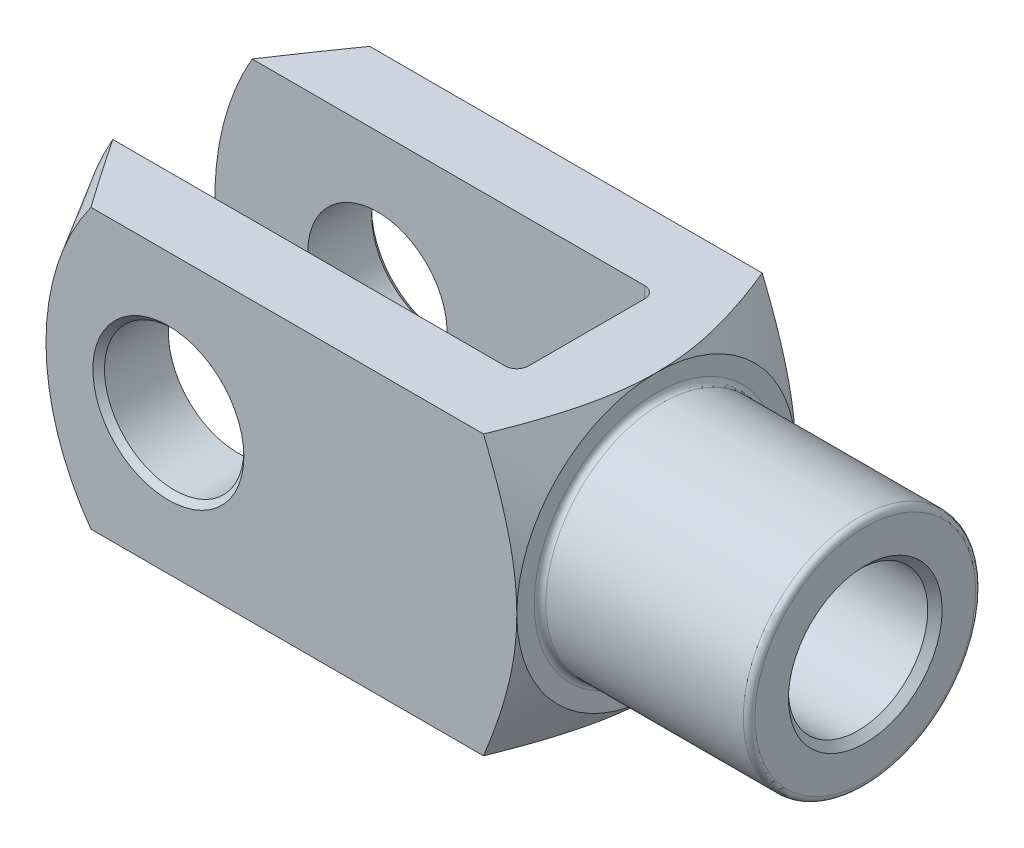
SolidWorks part; units mm, degrees
ref_plane "Front Plane" through (0, 0, 0) normal (0, 0, 1) x (1, 0, 0)
ref_plane "Top Plane" through (0, 0, 0) normal (0, 1, 0) x (1, 0, 0)
ref_plane "Right Plane" through (0, 0, 0) normal (1, 0, 0) x (0, 0, -1)
sketch "Sketch1" plane through (0, 0, 0) normal (1, 0, 0) x (0, 0, -1)
  line L0 (0, 0) -> (0, 50000) construction
  line L1 (0, 0) -> (50000, 0) construction
  line L2 (-12, -12) -> (-12, 12)
  line L3 (-12, 12) -> (12, 12)
  line L4 (12, -12) -> (12, 12)
  line L5 (-12, -12) -> (12, -12)
  point P9 (0, 12)
  point P11 (12, 0)
  point P12 (-12, 0)
  dimension "D1" = 24
  dimension "D2" = 24
extrude "Extrude1" add sketch "Sketch1" against normal blind 62
sketch "Sketch2" plane through (0, 0, 0) normal (1, 0, 0) x (0, 0, -1)
  circle A0 centre (0, 0) radius 10
  circle A1 centre (0, 0) radius 20
  dimension "D1" = 20
  dimension "D2" = 40
extrude "Extrude2" cut sketch "Sketch2" against normal blind 18
sketch "Sketch3" plane through (0, 0, 12) normal (0, 0, 1) x (1, 0, 0)
  circle A0 centre (-48, 0) radius 6
  dimension "D1" = 12
  dimension "D2" = 48
extrude "Extrude3" cut sketch "Sketch3" against normal through all
sketch "Sketch4" plane through (0, 12, 0) normal (0, 1, 0) x (1, 0, 0)
  line L0 (0, 0) -> (-50000, 0) construction
  line L1 (-62, -6) -> (-62, 6)
  line L2 (-62, 12) -> (-62, -12) construction
  line L3 (-62, 6) -> (-24, 6)
  line L4 (-24, 6) -> (-24, -6)
  line L5 (-48, 12) -> (-48, -12) construction
  line L6 (-62, -6) -> (-24, -6)
  point P7 (-48, 0)
  point P13 (-24, 0)
  point P14 (-62, 0)
  dimension "D1" = 24
  dimension "D2" = 12
extrude "Extrude4" cut sketch "Sketch4" against normal through all
fillet "Fillet1" radius 1 2 edges at (-24, 0, 6) (-24, 0, -6)
fillet "Fillet2" radius 0.5 2 edges at (0, 0, -10) (-18, 0, -10)
chamfer "Chamfer2" distance 0.5 angle 45 2 edges at (-42, 0, -12) (-42, 0, 12)
sketch "Sketch6" plane through (0, 0, 0) normal (0, 0, 1) x (1, 0, 0)
  line L0 (-18, -12) -> (-18, -24)
  line L1 (-18, -24) -> (-24.9282, -24)
  line L2 (-24.9282, -24) -> (-18, -12)
  dimension "D1" = 30
  dimension "D2" = 24
revolve "Cut-Revolve1" cut sketch "Sketch6" angle 360 about axis through (-18, 0, 0) along (1, 0, 0)
sketch "Sketch7" plane through (0, 0, 0) normal (0, 1, 0) x (1, 0, 0)
  line L0 (-58.5359, -12) -> (-62, -6)
  line L1 (-62, 6) -> (-58.5359, 12)
  line L2 (-58.5359, 12) -> (-86, 12)
  line L3 (-62, 6) -> (-62, -6)
  line L4 (-86, 12) -> (-86, -12)
  line L5 (-86, -12) -> (-58.5359, -12)
  line L6 (-62, 12) -> (-20.8698, 12) construction
  line L7 (-62, -12) -> (-20.8698, -12) construction
  line L8 (-38, 0.6162) -> (-38, 50000.6162) construction
  dimension "D1" = 120
  dimension "D2" = 24
  dimension "D3" = 24
revolve "Cut-Revolve2" cut sketch "Sketch7" angle 180 about L8
sketch "Sketch8" plane through (0, 0, 0) normal (1, 0, 0) x (0, 0, -1)
  circle A0 centre (0, 0) radius 6
  dimension "D1" = 12
extrude "Extrude5" cut sketch "Sketch8" against normal through all
chamfer "Chamfer3" distance 0.62 angle 45 1 edges at (0, 0, -6)
equation "\"D2@Sketch1\" = \"D1@Sketch1\""
equation "\"D2@Sketch2\" = \"D1@Sketch2\"*2"
equation "\"D2@Sketch6\" = \"D1@Sketch1\""
equation "\"D2@Sketch7\" = \"D1@Sketch1\""
equation "\"D3@Sketch7\" = \"D1@Sketch1\""
